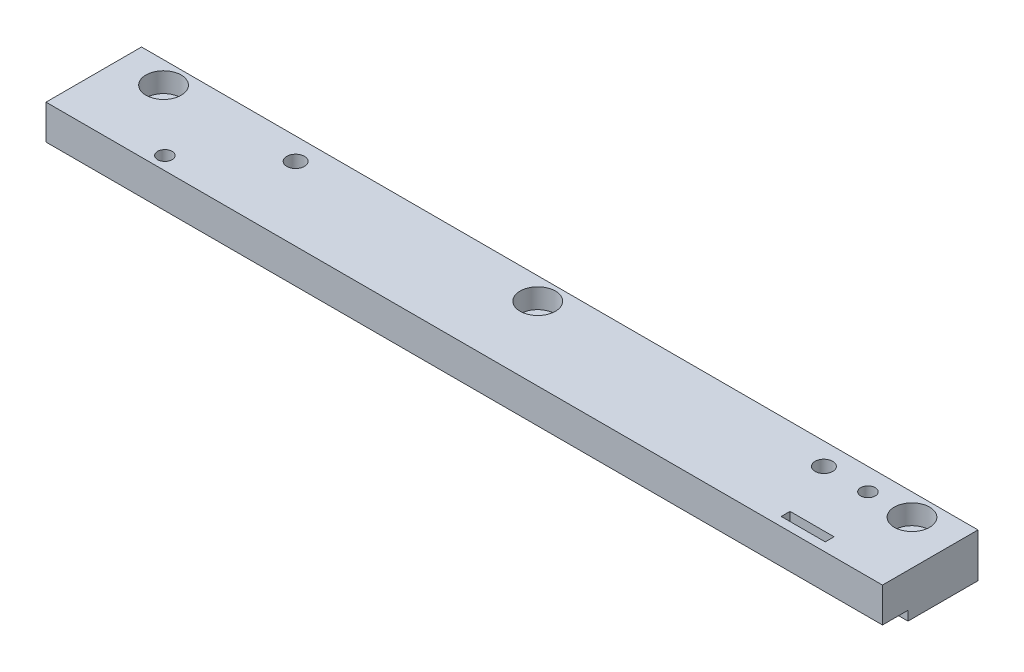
SolidWorks part; units mm, degrees
ref_plane "前视基准面" through (0, 0, 0) normal (0, 0, 1) x (1, 0, 0)
ref_plane "上视基准面" through (0, 0, 0) normal (0, 1, 0) x (1, 0, 0)
ref_plane "右视基准面" through (0, 0, 0) normal (1, 0, 0) x (0, 0, -1)
sketch "草图1" plane through (0, 0, 0) normal (0, 0, 1) x (1, 0, 0)
  line L0 (0, 0) -> (190, 0)
  line L1 (0, 10) -> (190, 10)
  line L2 (0, 0) -> (0, 10)
  line L3 (190, 0) -> (190, 10)
extrude "凸台-拉伸1" add sketch "草图1" along normal blind 21.7
sketch "草图2" plane through (190, 0, 0) normal (1, 0, 0) x (0, 0, -1)
  line L0 (0, 0) -> (0, 10)
  line L1 (-21.7, 2.14) -> (-21.7, 10)
  line L2 (-15.9, 0) -> (0, 0)
  line L3 (-15.9, 0) -> (-15.9, 2.14)
  line L4 (-21.7, 2.14) -> (-15.9, 2.14)
  line L5 (-21.7, 10) -> (0, 10)
extrude "切除-拉伸1" cut sketch "草图2" against normal through all flip side to cut
sketch "草图3" plane through (0, 10, 0) normal (0, 1, 0) x (1, 0, 0)
  line L0 (165, -19.7) -> (165, -17.7)
  line L1 (175, -19.7) -> (175, -17.7)
  line L2 (165, -19.7) -> (175, -19.7)
  line L3 (165, -17.7) -> (175, -17.7)
  circle A0 centre (10, -5) radius 2.25
  circle A1 centre (95, -5) radius 2.25
  circle A2 centre (180, -5) radius 2.25
  circle A3 centre (40, -5) radius 2
  circle A4 centre (160, -5) radius 2
  circle A5 centre (170, -5) radius 1.65
  circle A6 centre (24, -18.7) radius 1.65
extrude "切除-拉伸2" cut sketch "草图3" against normal blind 21.7
sketch "草图4" plane through (0, 10, 0) normal (0, 1, 0) x (1, 0, 0)
  circle A0 centre (10, -5) radius 4
  circle A1 centre (95, -5) radius 4
  circle A2 centre (180, -5) radius 4
extrude "切除-拉伸3" cut sketch "草图4" against normal blind 4.5
